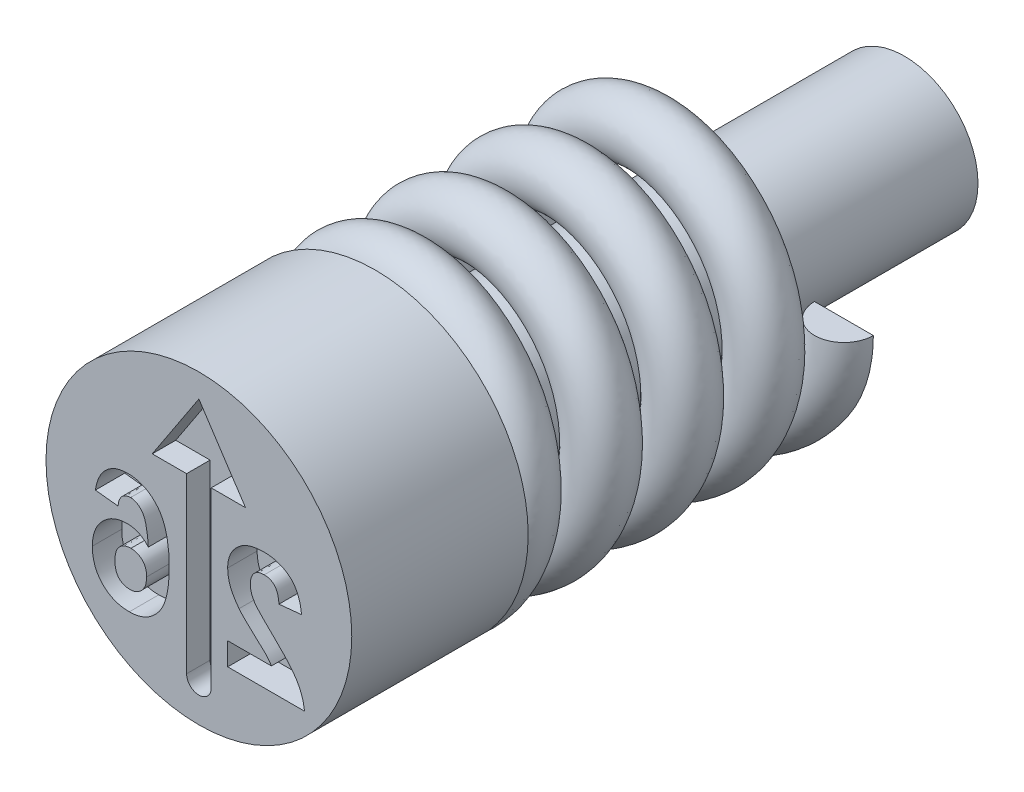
SolidWorks part; units mm, degrees
other "<DCSPR10>-<Cut-Extrude1>"
ref_plane "Front Plane" through (0, 0, 0) normal (0, 0, 1) x (1, 0, 0)
ref_plane "Top Plane" through (0, 0, 0) normal (0, 1, 0) x (1, 0, 0)
ref_plane "Right Plane" through (0, 0, 0) normal (1, 0, 0) x (0, 0, -1)
sketch "Sketch2" plane through (0, 0, 0) normal (0, 1, 0) x (1, 0, 0)
  line L5 (2.6, 0) -> (2.6, 3)
  line L6 (2.6, 3) -> (1.25, 3)
  line L7 (1.25, 3) -> (1.25, 12)
  line L8 (1.25, 12) -> (0, 12)
  line L9 (0, 0) -> (2.6, 0)
  line L10 (0, 0) -> (0, 50000) construction
  line L11 (0, 12) -> (0, 0)
  dimension "D1" = 3
  dimension "D2" = 12
  dimension "D3" = 5.2
  dimension "D4" = 2.5
revolve "Revolve1" add sketch "Sketch2" angle 360 about L10
sketch "Sketch3" plane through (0, 0, 0) normal (0, 0, 1) x (1, 0, 0)
  line L0 (-0.2093, 0.9958) -> (-0.7931, 0.9958)
  line L1 (0, -0.9219) -> (0, 0.9385) construction
  line L2 (-0.2093, -1.9514) -> (-0.2093, 0.9958)
  line L3 (-0.7931, 0.9958) -> (0, 2.1996)
  line L12 (0.7931, 0.9958) -> (0, 2.1996)
  line L16 (0.2093, -1.9514) -> (0.2093, 0.9958)
  line L17 (0.2093, 0.9958) -> (0.7931, 0.9958)
  arc A2 (-0.2093, -1.9514) -> (0.2093, -1.9514) centre (0, -1.9514) ccw
extrude "Cut-Extrude1" cut sketch "Sketch3" against normal blind 0.4
sketch "Sketch4" plane through (0, 0, 0) normal (0, 0, 1) x (1, 0, 0)
  text T0 "2  6" font "Arial" height 2
  dimension "D1" = 1.5
  dimension "D2" = 1.9
extrude "Cut-Extrude2" cut sketch "Sketch4" against normal blind 0.5
inserted part "DCSPR10"
move or copy body "Body-Move/Copy2" placed by mates yes
